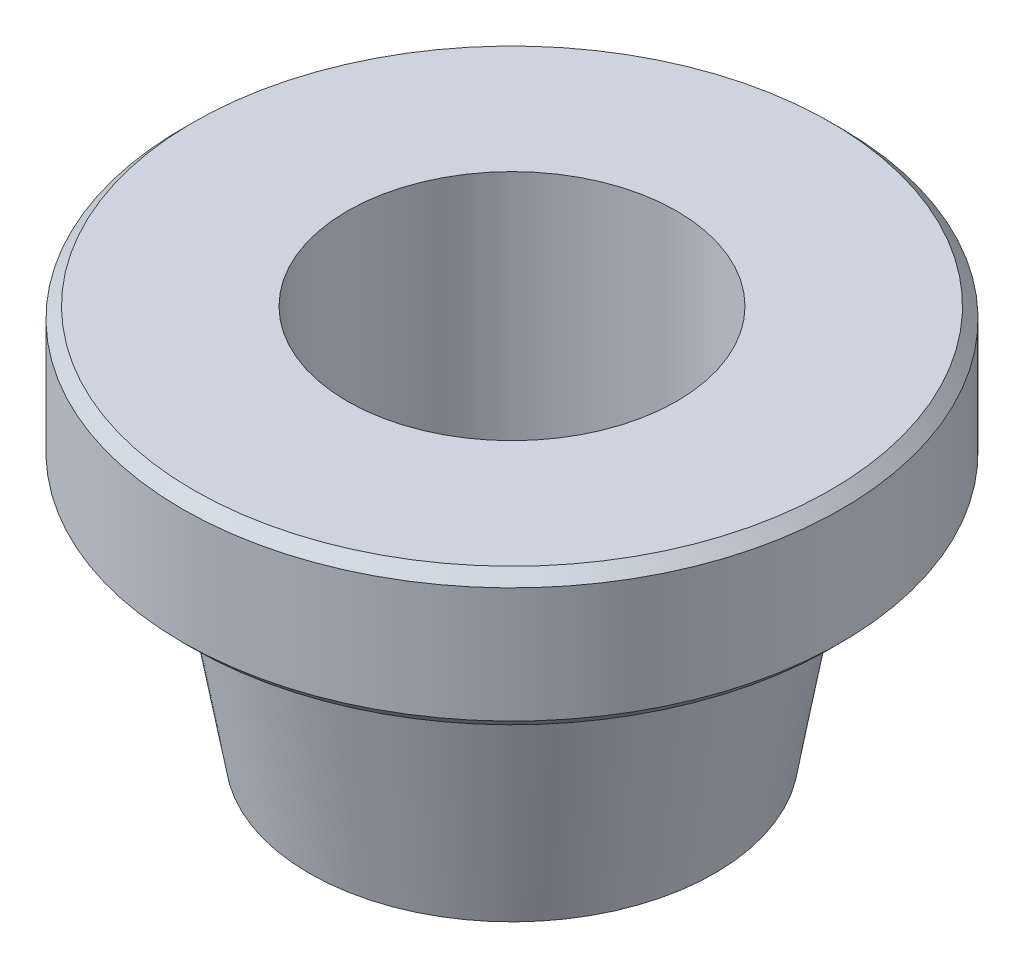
SolidWorks part; units mm, degrees
ref_plane "Přední rovina" through (0, 0, 0) normal (0, 0, 1) x (1, 0, 0)
ref_plane "Horní rovina" through (0, 0, 0) normal (0, 1, 0) x (1, 0, 0)
ref_plane "Pravá rovina" through (0, 0, 0) normal (1, 0, 0) x (0, 0, -1)
sketch "Skica1" plane through (0, 0, 0) normal (0, 1, 0) x (1, 0, 0)
  circle A0 centre (0, 0) radius 4.5
extrude "Přidat vysunutím1" add sketch "Skica1" against normal blind 4.6 draft 10
sketch "Skica2" plane through (0, 0, 0) normal (0, 1, 0) x (-1, 0, 0)
  circle A0 centre (0, 0) radius 6
extrude "Přidat vysunutím2" add sketch "Skica2" along normal blind 2.5
chamfer "Zkosení1" distance 0.2 angle 45 2 edges at (0, 0, 6) (0, 2.5, 6)
sketch "Skica3" plane through (0, 2.5, 0) normal (0, 1, 0) x (1, 0, 0)
  circle A0 centre (0, 0) radius 3
extrude "Odebrat vysunutím1" cut sketch "Skica3" against normal blind 2.5
sketch "Skica4" plane through (0, -4.6, 0) normal (0, -1, 0) x (1, 0, 0)
  circle A0 centre (0, 0) radius 3
extrude "Odebrat vysunutím2" cut sketch "Skica4" against normal up to surface (4.6 mm away)
sketch "Skica5" plane through (0, 0, 0) normal (0, 0, 1) x (1, 0, 0)
  line L0 (-3.6889, -4.6) -> (3.6889, -4.6) construction
  line L1 (-3.3, -3.6) -> (-3, -3.6)
  line L2 (-3.3, -3.6) -> (-3.3, -3.1)
  line L3 (-3.3, -3.1) -> (-3, -3.1)
  line L4 (-3, -3.6) -> (-3, -3.1)
  line L7 (-3, -4.6) -> (3, -4.6) construction
  point P8 (-3.25, -4.6)
  dimension "D1" = 0.3
  dimension "D2" = 0.5
  dimension "D3" = 1
ref_axis "Osa1" through (0, 2.5, 0) along (0, -1, 0)
revolve "Odebrat rotací1" cut sketch "Skica5" angle 360 about axis through (0, 2.5, 0) along (0, -1, 0)
